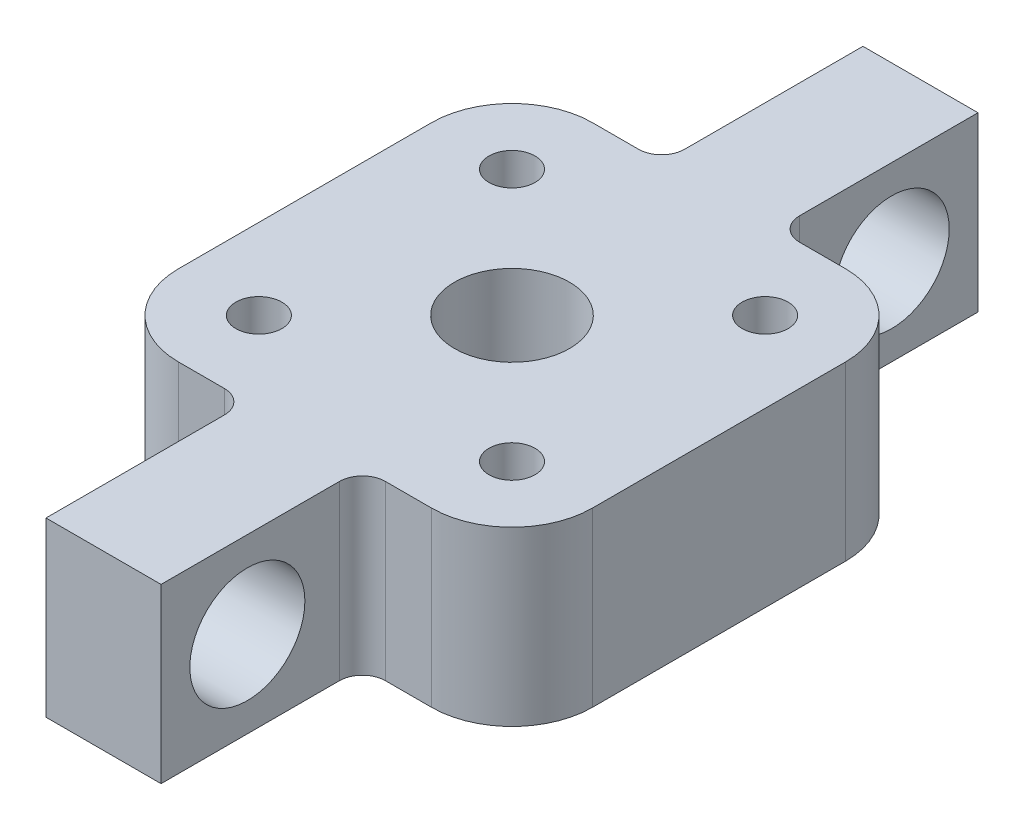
SolidWorks part; units mm, degrees
ref_plane "Front Plane" through (0, 0, 0) normal (0, 0, 1) x (1, 0, 0)
ref_plane "Top Plane" through (0, 0, 0) normal (0, 1, 0) x (1, 0, 0)
ref_plane "Right Plane" through (0, 0, 0) normal (1, 0, 0) x (0, 0, -1)
sketch "Sketch1" plane through (0, 0, 0) normal (0, 1, 0) x (1, 0, 0)
  line L0 (-5, 18) -> (-5, 35.5)
  line L1 (18, 18) -> (5, 18)
  line L2 (18, 18) -> (18, -18)
  line L3 (18, -18) -> (5, -18)
  line L4 (-18, 18) -> (-18, -18)
  line L5 (18, 18) -> (-18, -18) construction
  line L6 (18, -18) -> (-18, 18) construction
  line L7 (-5, 35.5) -> (5, 35.5)
  line L8 (5, 35.5) -> (5, 18)
  line L9 (-364.9045, 0) -> (17880.3204, 0) construction
  line L10 (0, -364.9045) -> (0, 17880.3204) construction
  line L11 (5, -35.5) -> (5, -18)
  line L12 (-5, -35.5) -> (5, -35.5)
  line L13 (-5, -18) -> (-5, -35.5)
  line L14 (-5, -18) -> (-18, -18)
  line L15 (-5, 18) -> (-18, 18)
  circle A0 centre (0, 0) radius 5
  circle A1 centre (-11, -11) radius 2
  circle A2 centre (11, -11) radius 2
  circle A3 centre (11, 11) radius 2
  circle A4 centre (-11, 11) radius 2
  dimension "D2" = 10
  dimension "D6" = 4
  dimension "D1" = 36
  dimension "D3" = 10
  dimension "D4" = 17.5
  dimension "D5" = 36
  dimension "D7" = 22
  dimension "D8" = 22
extrude "Boss-Extrude1" add sketch "Sketch1" along normal mid plane 15
fillet "Fillet1" radius 7 4 edges at (18, 0, 18) (18, 0, -18) (-18, 0, -18) (-18, 0, 18)
fillet "Fillet2" radius 2 4 edges at (-5, 0, 18) (-5, 0, -18) (5, 0, -18) (5, 0, 18)
sketch "Sketch3" plane through (5, 0, 0) normal (1, 0, 0) x (0, 0, -1)
  line L0 (0, -1000) -> (0, 1000) construction
  line L1 (-35.5, 7.5) -> (-35.5, -7.5) construction
  circle A0 centre (-28, 0) radius 5
  circle A1 centre (28, 0) radius 5
  point P9 (-35.5, 0)
  dimension "D1" = 10
  dimension "D2" = 7.5
extrude "Cut-Extrude2" cut sketch "Sketch3" against normal blind 27
